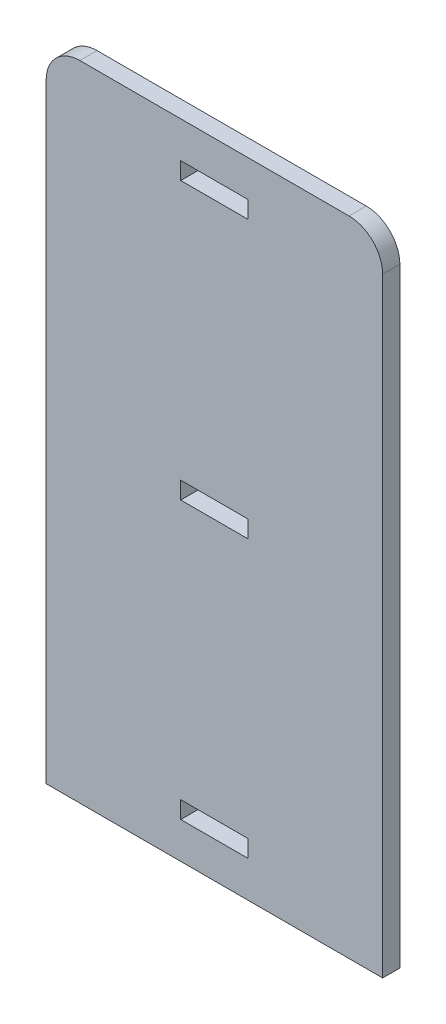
SolidWorks part; units mm, degrees
ref_plane "Alzado" through (0, 0, 0) normal (0, 0, 1) x (1, 0, 0)
ref_plane "Planta" through (0, 0, 0) normal (0, 1, 0) x (1, 0, 0)
ref_plane "Vista lateral" through (0, 0, 0) normal (1, 0, 0) x (0, 0, -1)
sketch "Croquis1" plane through (0, 0, 0) normal (0, 0, 1) x (1, 0, 0)
  line L0 (-224.5827, -626.9612) -> (225.4173, -626.9612)
  line L1 (225.4173, 183.0388) -> (225.4173, 188.0388)
  line L2 (180.4173, 233.0388) -> (-179.5827, 233.0388)
  line L3 (-224.5827, 188.0388) -> (-224.5827, -626.9612)
  line L5 (-44.5827, 161.5388) -> (-44.5827, 184.5388)
  line L7 (-44.5827, -578.4612) -> (-44.5827, -555.4612)
  line L8 (225.4173, -626.9612) -> (225.4173, 183.0388)
  line L10 (45.4173, -555.4612) -> (45.4173, -578.4612)
  line L12 (45.4173, -185.4612) -> (45.4173, -208.4612)
  line L14 (-44.5827, -208.4612) -> (-44.5827, -185.4612)
  line L16 (45.4173, 184.5388) -> (45.4173, 161.5388)
  line L18 (45.4173, 183.0388) -> (45.4173, 163.0388)
  line L19 (-44.5827, 163.0388) -> (-44.5827, 183.0388)
  line L27 (-44.5827, 184.5388) -> (45.4173, 184.5388)
  line L28 (45.4173, 161.5388) -> (-44.5827, 161.5388)
  line L29 (-44.5827, -185.4612) -> (45.4173, -185.4612)
  line L30 (45.4173, -208.4612) -> (-44.5827, -208.4612)
  line L31 (-44.5827, -555.4612) -> (45.4173, -555.4612)
  line L32 (45.4173, -578.4612) -> (-44.5827, -578.4612)
  arc A0 (225.4173, 188.0388) -> (180.4173, 233.0388) centre (180.4173, 188.0388) ccw
  arc A1 (-179.5827, 233.0388) -> (-224.5827, 188.0388) centre (-179.5827, 188.0388) ccw
  dimension "D2" = 45
  dimension "D7" = 20
extrude "Saliente-Extruir1" add sketch "Croquis1" along normal blind 23
